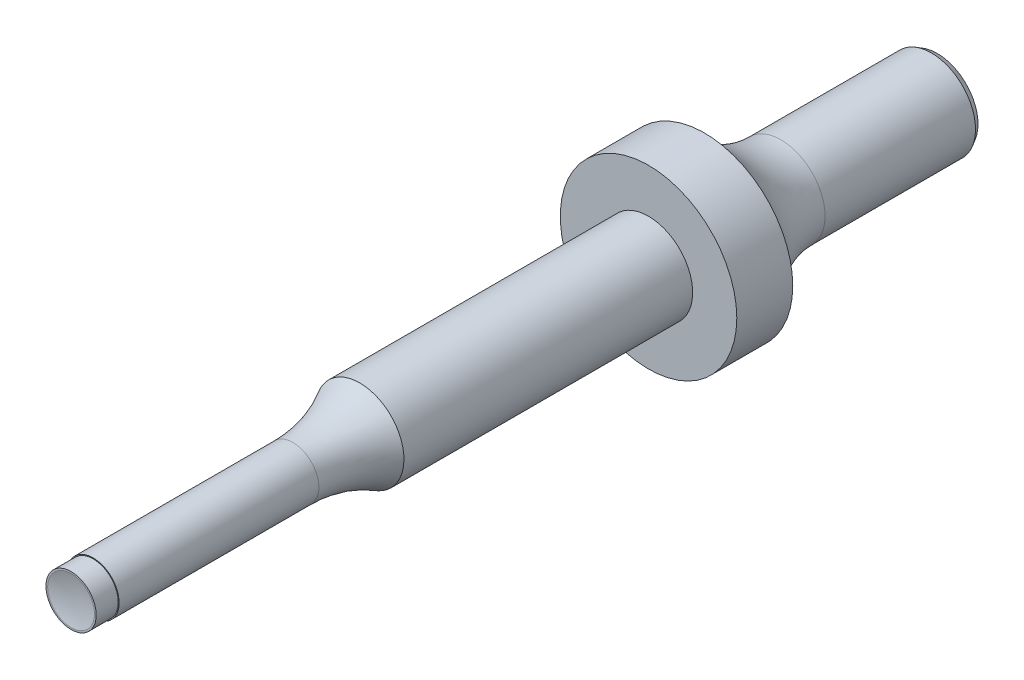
SolidWorks part; units mm, degrees
ref_plane "Front Plane" through (0, 0, 0) normal (0, 0, 1) x (1, 0, 0)
ref_plane "Top Plane" through (0, 0, 0) normal (0, 1, 0) x (1, 0, 0)
ref_plane "Right Plane" through (0, 0, 0) normal (1, 0, 0) x (0, 0, -1)
sketch "Sketch1" plane through (0, 0, 0) normal (0, 0, 1) x (1, 0, 0)
  circle A0 centre (0, 0) radius 5.095
  dimension "D1" = 10.19
extrude "Boss-Extrude1" add sketch "Sketch1" against normal blind 100
sketch "Sketch2" plane through (0, 0, 0) normal (0, 0, 1) x (1, 0, 0)
  circle A0 centre (0, 0) radius 3
  dimension "D1" = 6
extrude "Cut-Extrude1" cut sketch "Sketch2" against normal blind 33.3333 flip side to cut
sketch "Sketch3" plane through (0, 0, 0) normal (0, 0, 1) x (1, 0, 0)
  circle A0 centre (0, 0) radius 2.9
  dimension "D1" = 5.8
extrude "Cut-Extrude2" cut sketch "Sketch3" against normal blind 2.5475 flip side to cut
sketch "Sketch4" plane through (0, 0, 0) normal (1, 0, 0) x (0, 0, -1)
  line L0 (0, 0) -> (0, 2.7)
  line L1 (0, 2.9) -> (0, -2.9) construction
  line L2 (0.3642, 0) -> (0.3642, 2.7) construction
  line L3 (0, 0) -> (0.3642, 0)
  line L4 (0, 0) -> (0, -2.7) construction
  arc A0 (0.3642, 0) -> (0, 2.7) centre (-9.8258, 0) ccw
  dimension "D2" = 10.19
  dimension "D1" = 5.4
revolve "Cut-Revolve1" cut sketch "Sketch4" angle 360 about L3
chamfer "Chamfer1" distance 0.6793 angle 30 1 edges at (5.095, 0, -100)
sketch "Sketch5" plane through (0, 0, 0) normal (1, 0, 0) x (0, 0, -1)
  line L0 (33.3333, 0) -> (25.6097, 0)
  line L1 (33.3333, 5.095) -> (33.3333, -5.095) construction
  line L2 (25.6097, 0) -> (25.6097, 3)
  line L3 (33.3333, 3) -> (2.5475, 3) construction
  line L4 (33.3333, 5.095) -> (33.3333, 0)
  line L5 (25.6097, 3) -> (33.3333, 3) construction
  arc A0 (25.6097, 3) -> (33.3333, 5.095) centre (25.6097, 18.285) ccw
  dimension "D1" = 15.285
revolve "Revolve1" add sketch "Sketch5" angle 360 about L0
sketch "Sketch6" plane through (0, 0, 0) normal (1, 0, 0) x (0, 0, -1)
  line L0 (66.6667, 0) -> (81.9517, 0)
  line L1 (66.6667, 0) -> (66.6667, 10.19)
  line L2 (66.6667, 10.19) -> (73.1269, 10.19)
  line L3 (81.9517, 0) -> (81.9517, 5.095)
  line L4 (99.3207, 5.095) -> (33.3333, 5.095) construction
  line L5 (81.9517, 5.095) -> (66.6667, 5.095) construction
  line L6 (100, -5.095) -> (100, 5.095) construction
  arc A0 (81.9517, 5.095) -> (73.1269, 10.19) centre (81.9517, 15.285) cw
  dimension "D2" = 10.19
  dimension "D1" = 33.3333
  dimension "D3" = 15.285
revolve "Revolve2" add sketch "Sketch6" angle 360 about L0
sketch "Sketch7" plane through (0, 0, -100) normal (0, 0, -1) x (-1, 0, 0)
  line L9 (-8.6234, 1.9603) -> (-4.7028, 1.9603)
  line L10 (-8.6234, 1.9603) -> (-8.6234, -1.9603)
  line L11 (-8.6234, -1.9603) -> (-4.7028, -1.9603)
  line L12 (-4.7028, 1.9603) -> (-4.7028, -1.9603)
  circle A5 centre (0, 0) radius 5.095 construction
  circle A6 centre (0, 0) radius 4.7028 construction
  point P8 (-4.7028, 0)
extrude "Cut-Extrude3" [suppressed] cut sketch "Sketch7" against normal through all
